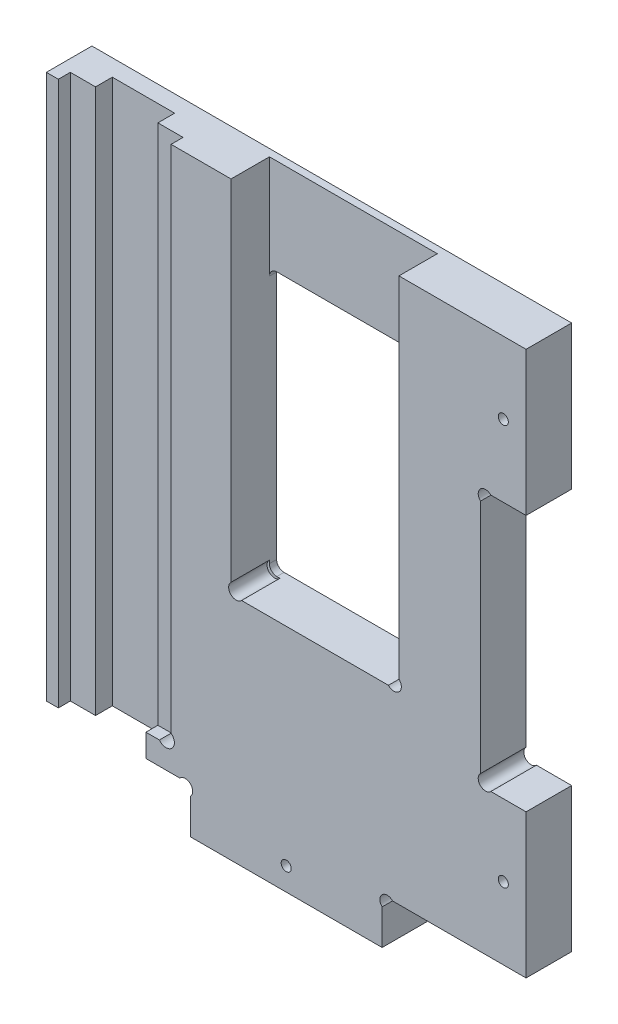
SolidWorks part; units mm, degrees
ref_plane "Plan de face" through (0, 0, 0) normal (0, 0, 1) x (1, 0, 0)
ref_plane "Plan de dessus" through (0, 0, 0) normal (0, 1, 0) x (1, 0, 0)
ref_plane "Plan de droite" through (0, 0, 0) normal (1, 0, 0) x (0, 0, -1)
sketch "Esquisse1" plane through (0, 0, 0) normal (0, 0, 1) x (1, 0, 0)
  line L20 (710.7292, 246) -> (510.7292, 246)
  line L21 (710.7292, 186) -> (710.7292, 246)
  line L22 (710.7292, 186) -> (696.0411, 186)
  line L23 (691.7292, 181.6881) -> (691.7292, 83.3119)
  line L24 (696.0411, 79) -> (710.7292, 79)
  line L25 (655.0411, 19) -> (710.7292, 19)
  line L26 (650.7292, 0) -> (650.7292, 14.6881)
  line L27 (566.3488, 19) -> (510.7292, 19)
  line L28 (570.7292, 0) -> (570.7292, 14.6196)
  line L29 (650.7292, 0) -> (570.7292, 0)
  line L30 (510.7292, 19) -> (510.7292, 246)
  line L31 (710.7292, 19) -> (710.7292, 79)
  arc A4 (691.7292, 181.6881) -> (696.0411, 186) centre (693.8292, 183.9) cw
  arc A5 (696.0411, 79) -> (691.7292, 83.3119) centre (693.8292, 81.1) cw
  arc A6 (650.7292, 14.6881) -> (655.0411, 19) centre (652.8292, 16.9) cw
  arc A7 (566.3488, 19) -> (570.7292, 14.6196) centre (568.6292, 16.9) cw
  circle A11 centre (701.2292, 216) radius 2.1
  circle A12 centre (701.2292, 49) radius 2.1
  circle A13 centre (610.7292, 9.5) radius 2.1
extrude "Boss.-Extru.1" add sketch "Esquisse1" along normal blind 19
sketch "Esquisse2" plane through (0, 0, 19) normal (0, 0, 1) x (1, 0, 0)
  line L0 (526.2292, 262.3559) -> (526.2292, -25.9943) construction
  line L1 (552.2292, 262.3559) -> (552.2292, -3.5046) construction
  line L2 (510.7292, 246) -> (510.7292, 19) construction
  line L4 (526.2292, 250.7094) -> (552.2292, 250.7094)
  line L5 (526.2292, 250.7094) -> (526.2292, 6.937)
  line L6 (526.2292, 6.937) -> (552.2292, 6.937)
  line L7 (552.2292, 250.7094) -> (552.2292, 6.937)
  dimension "D1" = 15.5
  dimension "D2" = 26
extrude "Enlèv. mat.-Extru.1" cut sketch "Esquisse2" against normal blind 12
sketch "Esquisse3" plane through (0, 0, 19) normal (0, 0, 1) x (1, 0, 0)
  line L0 (562.7292, 263.5652) -> (562.7292, -16.6689) construction
  line L1 (552.2292, 19) -> (552.2292, 246) construction
  line L2 (515.7292, 256.5984) -> (515.7292, 0) construction
  line L3 (562.7292, 251.308) -> (546.7512, 251.308)
  line L4 (562.7292, 251.308) -> (562.7292, 33.3804)
  line L5 (557.8488, 28.5) -> (546.7512, 28.5)
  line L6 (546.7512, 251.308) -> (546.7512, 28.5)
  line L7 (526.2292, 246) -> (526.2292, 19) construction
  line L8 (493.4468, 28.5) -> (587.7373, 28.5) construction
  line L9 (515.7292, 251.308) -> (533.0766, 251.308)
  line L10 (515.7292, 251.308) -> (515.7292, 9.7102)
  line L11 (515.7292, 9.7102) -> (533.0766, 9.7102)
  line L12 (533.0766, 251.308) -> (533.0766, 9.7102)
  line L13 (526.2292, 19) -> (552.2292, 19) construction
  arc A1 (557.8488, 28.5) -> (562.7292, 33.3804) centre (560.6292, 30.6) ccw
  dimension "D4" = 2.1
  dimension "D1" = 10.5
  dimension "D2" = 10.5
  dimension "D3" = 9.5
  dimension "D5" = 2.1
extrude "Enlèv. mat.-Extru.2" cut sketch "Esquisse3" against normal blind 5
sketch "Esquisse5" plane through (0, 0, 19) normal (0, 0, 1) x (1, 0, 0)
  line L0 (587.7292, 251.2033) -> (587.7292, 73.4012) construction
  line L1 (657.7292, 257.5621) -> (657.7292, 69.2436) construction
  line L2 (572.3311, 96) -> (678.2297, 96) construction
  line L3 (710.7292, 186) -> (710.7292, 246) construction
  line L4 (710.7292, 246) -> (562.7292, 246) construction
  line L6 (592.1095, 96) -> (653.3488, 96)
  line L8 (587.7292, 100.3804) -> (587.7292, 251.2033)
  line L10 (587.7292, 251.2033) -> (657.7292, 251.2033)
  line L11 (657.7292, 100.3804) -> (657.7292, 251.2033)
  arc A0 (653.3488, 96) -> (657.7292, 100.3804) centre (655.6292, 98.1) ccw
  arc A1 (587.7292, 100.3804) -> (592.1095, 96) centre (589.8292, 98.1) ccw
  point P15 (587.7292, 95.9799)
  dimension "D4" = 2.1
  dimension "D1" = 53
  dimension "D2" = 70
  dimension "D3" = 150
  dimension "D5" = 2.1
  dimension "D6" = 2.1
  dimension "D7" = 2.1
extrude "Enlèv. mat.-Extru.3" cut sketch "Esquisse5" against normal blind 16
sketch "Esquisse6" plane through (0, 0, 3) normal (0, 0, 1) x (1, 0, 0)
  line L1 (710.7292, 186) -> (710.7292, 246) construction
  line L2 (590.8292, 206) -> (654.6292, 206)
  line L3 (587.7292, 202.9) -> (587.7292, 99.1)
  line L4 (590.8292, 96) -> (654.6292, 96)
  line L8 (657.7292, 202.9) -> (657.7292, 99.1)
  line L9 (657.7292, 246) -> (587.7292, 246) construction
  arc A0 (587.7292, 99.1) -> (590.8292, 96) centre (590.8292, 99.1) ccw
  arc A1 (654.6292, 96) -> (657.7292, 99.1) centre (654.6292, 99.1) ccw
  arc A2 (654.6292, 206) -> (657.7292, 202.9) centre (654.6292, 202.9) cw
  arc A3 (590.8292, 206) -> (587.7292, 202.9) centre (590.8292, 202.9) ccw
  dimension "D5" = 3.1
  dimension "D1" = 53
  dimension "D2" = 70
  dimension "D3" = 150
  dimension "D4" = 40
extrude "Enlèv. mat.-Extru.4" cut sketch "Esquisse6" against normal through all
